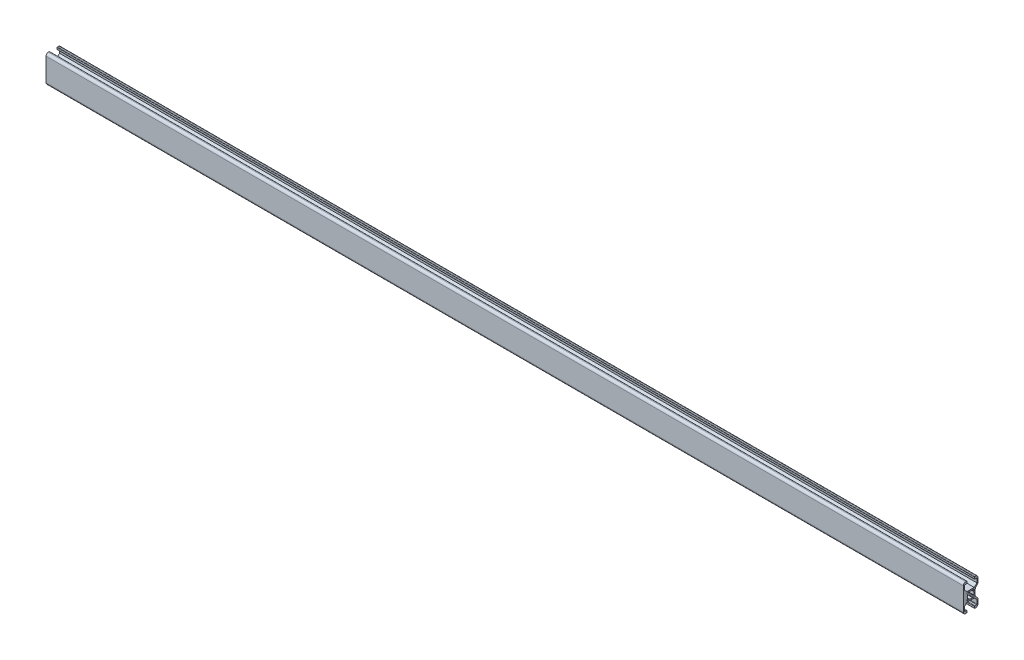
SolidWorks part; units mm, degrees
ref_plane "Front Plane" through (0, 0, 0) normal (0, 0, 1) x (1, 0, 0)
ref_plane "Top Plane" through (0, 0, 0) normal (0, 1, 0) x (1, 0, 0)
ref_plane "Right Plane" through (0, 0, 0) normal (1, 0, 0) x (0, 0, -1)
sketch "Sketch1" plane through (0, 0, 0) normal (0, 0, 1) x (1, 0, 0)
  line L0 (0, 0) -> (1000, 0)
  dimension "D1" = 1000
other "30-sarja 1.0002 16X30(1)"
ref_plane "Plane1" through (0, 0, 0) normal (1, 0, 0) x (0, 0, -1)
sketch "Model" plane through (0, 0, 0) normal (1, 0, 0) x (0, 0, -1)
  line L0 (-2.2431, 3.6573) -> (-3.2859, 3.8789)
  line L1 (-3.8789, 3.2859) -> (-3.6573, 2.2431)
  line L2 (-3.6573, 2.2431) -> (-3.3633, 1.9491)
  line L3 (-3.3633, -1.9491) -> (-3.6573, -2.2431)
  line L4 (-3.6573, -2.2431) -> (-3.8789, -3.2859)
  line L5 (-3.2859, -3.8789) -> (-2.2431, -3.6573)
  line L6 (-2.2431, -3.6573) -> (-1.9491, -3.3633)
  line L7 (1.9491, -3.3633) -> (2.2431, -3.6573)
  line L8 (2.2431, -3.6573) -> (3.2859, -3.8789)
  line L9 (3.8789, -3.2859) -> (3.6573, -2.2431)
  line L10 (3.6573, -2.2431) -> (3.3633, -1.9491)
  line L11 (3.3633, 1.9491) -> (3.6573, 2.2431)
  line L12 (3.6573, 2.2431) -> (3.8789, 3.2859)
  line L13 (3.2859, 3.8789) -> (2.2431, 3.6573)
  line L14 (2.2431, 3.6573) -> (1.9491, 3.3633)
  line L15 (-1.9491, 3.3633) -> (-2.2431, 3.6573)
  line L16 (6.8, -7.8607) -> (6.8, -12.2)
  line L17 (3.9393, -5) -> (6.8, -7.8607)
  line L18 (-3.9393, -5) -> (3.9393, -5)
  line L19 (-6.8, -7.8607) -> (-3.9393, -5)
  line L20 (-6.8, -12.2) -> (-6.8, -7.8607)
  line L21 (-4.6, -12.5) -> (-6.5, -12.5)
  line L22 (-4.1, -14.7) -> (-4.1, -13)
  line L23 (-5.5, -15) -> (-4.4, -15)
  line L24 (-8, 12.5) -> (-8, -12.5)
  line L25 (-4.4, 15) -> (-5.5, 15)
  line L26 (-4.1, 13) -> (-4.1, 14.7)
  line L27 (-6.5, 12.5) -> (-4.6, 12.5)
  line L28 (-6.8, 7.8606) -> (-6.8, 12.2)
  line L29 (-3.9393, 5) -> (-6.8, 7.8606)
  line L30 (3.9393, 5) -> (-3.9393, 5)
  line L31 (6.8, 7.8606) -> (3.9393, 5)
  line L32 (6.8, 12.2) -> (6.8, 7.8606)
  line L33 (4.6, 12.5) -> (6.5, 12.5)
  line L34 (4.1, 14.7) -> (4.1, 13)
  line L35 (5.5, 15) -> (4.4, 15)
  line L36 (8, 7.9749) -> (8, 12.5)
  line L37 (5.7322, 4.6716) -> (7.2678, 6.2071)
  line L38 (5, -2.9038) -> (5, 2.9038)
  line L39 (7.2678, -6.2071) -> (5.7322, -4.6716)
  line L40 (8, -12.5) -> (8, -7.9749)
  line L41 (4.4, -15) -> (5.5, -15)
  line L42 (4.1, -13) -> (4.1, -14.7)
  line L43 (6.5, -12.5) -> (4.6, -12.5)
  arc A0 (-3.2859, 3.8789) -> (-3.8789, 3.2859) centre (-3.3898, 3.3898) ccw
  arc A1 (-3.3056, 1.6059) -> (-3.3633, 1.9491) centre (-3.5754, 1.737) ccw
  arc A2 (-3.3056, 1.6059) -> (-3.3056, -1.6059) centre (0, 0) ccw
  arc A3 (-3.3633, -1.9491) -> (-3.3056, -1.6059) centre (-3.5754, -1.7369) ccw
  arc A4 (-3.8789, -3.2859) -> (-3.2859, -3.8789) centre (-3.3898, -3.3898) ccw
  arc A5 (-1.6059, -3.3056) -> (-1.9491, -3.3633) centre (-1.7369, -3.5754) ccw
  arc A6 (-1.6059, -3.3056) -> (1.6059, -3.3056) centre (0, 0) ccw
  arc A7 (1.9491, -3.3633) -> (1.6059, -3.3056) centre (1.737, -3.5754) ccw
  arc A8 (3.2859, -3.8789) -> (3.8789, -3.2859) centre (3.3898, -3.3898) ccw
  arc A9 (3.3056, -1.6059) -> (3.3633, -1.9491) centre (3.5754, -1.7369) ccw
  arc A10 (3.3056, -1.6059) -> (3.3056, 1.6059) centre (0, 0) ccw
  arc A11 (3.3633, 1.9491) -> (3.3056, 1.6059) centre (3.5754, 1.737) ccw
  arc A12 (3.8789, 3.2859) -> (3.2859, 3.8789) centre (3.3898, 3.3898) ccw
  arc A13 (1.6059, 3.3056) -> (1.9491, 3.3633) centre (1.7369, 3.5754) ccw
  arc A14 (1.6059, 3.3056) -> (-1.6059, 3.3056) centre (0, 0) ccw
  arc A15 (-1.9491, 3.3633) -> (-1.6059, 3.3056) centre (-1.7369, 3.5754) ccw
  arc A16 (-6.8, -12.2) -> (-6.5, -12.5) centre (-6.5, -12.2) ccw
  arc A17 (-4.1, -13) -> (-4.6, -12.5) centre (-4.6, -13) ccw
  arc A18 (-4.4, -15) -> (-4.1, -14.7) centre (-4.4, -14.7) ccw
  arc A19 (-8, -12.5) -> (-5.5, -15) centre (-5.5, -12.5) ccw
  arc A20 (-5.5, 15) -> (-8, 12.5) centre (-5.5, 12.5) ccw
  arc A21 (-4.1, 14.7) -> (-4.4, 15) centre (-4.4, 14.7) ccw
  arc A22 (-4.6, 12.5) -> (-4.1, 13) centre (-4.6, 13) ccw
  arc A23 (-6.5, 12.5) -> (-6.8, 12.2) centre (-6.5, 12.2) ccw
  arc A24 (6.8, 12.2) -> (6.5, 12.5) centre (6.5, 12.2) ccw
  arc A25 (4.1, 13) -> (4.6, 12.5) centre (4.6, 13) ccw
  arc A26 (4.4, 15) -> (4.1, 14.7) centre (4.4, 14.7) ccw
  arc A27 (8, 12.5) -> (5.5, 15) centre (5.5, 12.5) ccw
  arc A28 (7.2678, 6.2071) -> (8, 7.9749) centre (5.5, 7.9749) ccw
  arc A29 (5.7322, 4.6716) -> (5, 2.9038) centre (7.5, 2.9038) ccw
  arc A30 (5, -2.9038) -> (5.7322, -4.6716) centre (7.5, -2.9038) ccw
  arc A31 (8, -7.9749) -> (7.2678, -6.2071) centre (5.5, -7.9749) ccw
  arc A32 (5.5, -15) -> (8, -12.5) centre (5.5, -12.5) ccw
  arc A33 (4.1, -14.7) -> (4.4, -15) centre (4.4, -14.7) ccw
  arc A34 (4.6, -12.5) -> (4.1, -13) centre (4.6, -13) ccw
  arc A35 (6.5, -12.5) -> (6.8, -12.2) centre (6.5, -12.2) ccw
  point P113 (-8, 0)
  point P114 (0, 0)
  point P115 (-8, -15)
  point P116 (0, -15)
  point P117 (8, -15)
  point P118 (8, 0)
  point P119 (8, 15)
  point P120 (0, 15)
  point P121 (-8, 15)
  point P122 (0, 0)
